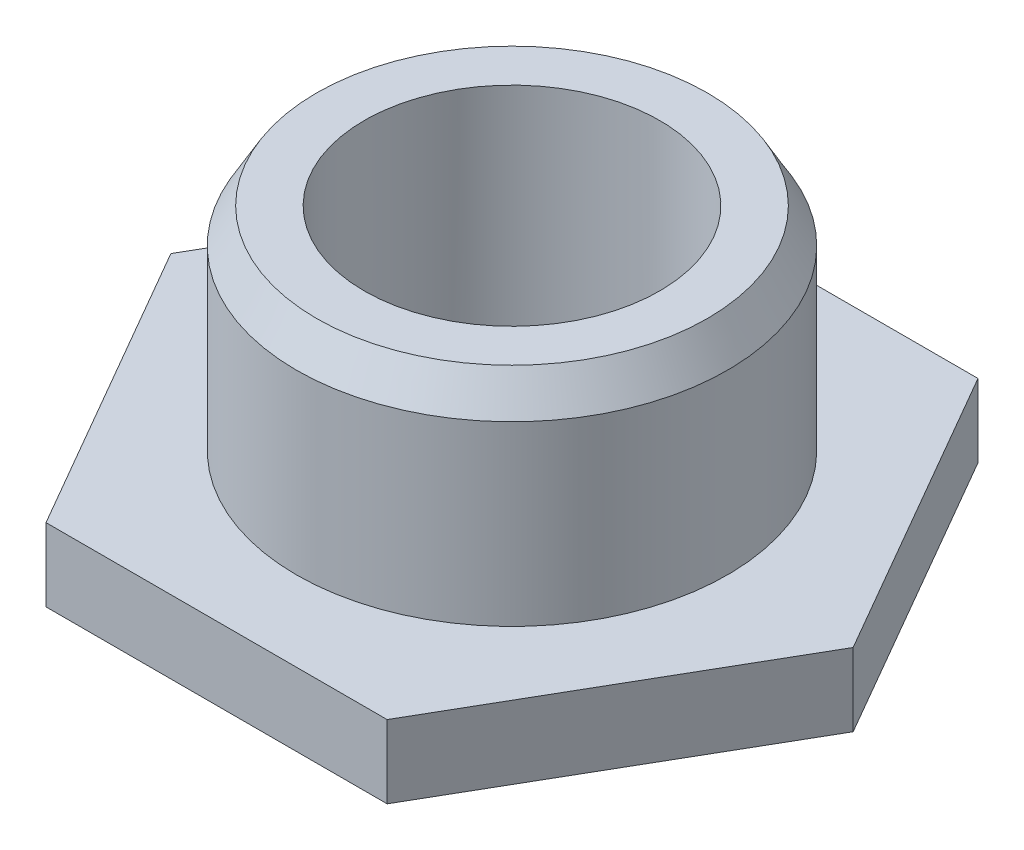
SolidWorks part; units mm, degrees
ref_plane "Front" through (0, 0, 0) normal (0, 0, 1) x (1, 0, 0)
ref_plane "Top" through (0, 0, 0) normal (0, 1, 0) x (1, 0, 0)
ref_plane "Right" through (0, 0, 0) normal (1, 0, 0) x (0, 0, -1)
sketch "Sketch1" plane through (0, 0, 0) normal (0, 1, 0) x (1, 0, 0)
  line L1 (9.815, 0) -> (4.9075, 8.5)
  line L2 (4.9075, 8.5) -> (-4.9075, 8.5)
  line L3 (-4.9075, 8.5) -> (-9.815, 0)
  line L4 (-9.815, 0) -> (-4.9075, -8.5)
  line L5 (-4.9075, -8.5) -> (4.9075, -8.5)
  line L6 (4.9075, -8.5) -> (9.815, 0)
  circle A0 centre (0, 0) radius 8.5 construction
  dimension "D1" = 17
extrude "Boss-Extrude1" add sketch "Sketch1" along normal blind 2.1
sketch "Sketch2" plane through (0, 2.1, 0) normal (0, 1, 0) x (1, 0, 0)
  circle A0 centre (0, 0) radius 6.2
  dimension "D1" = 12.4
extrude "Boss-Extrude2" add sketch "Sketch2" along normal blind 6.1
sketch "Sketch3" plane through (0, 0, 0) normal (1, 0, 0) x (0, 0, -1)
  line L0 (0, 3) -> (7.7, 0)
  line L1 (0, 0) -> (8.5, 0) construction
  line L2 (7.7, 0) -> (0, 0)
  line L3 (0, 0) -> (0, 3)
  line L4 (8.5, 2.1) -> (8.5, 0) construction
  dimension "D1" = 3
  dimension "D2" = 0.8
revolve "Cut-Revolve1" cut sketch "Sketch3" angle 360 about L3
sketch "Sketch4" plane through (0, 8.2, 0) normal (0, 1, 0) x (1, 0, 0)
  circle A0 centre (0, 0) radius 4.25
  dimension "D1" = 8.5
extrude "Cut-Extrude1" cut sketch "Sketch4" against normal through all
chamfer "Chamfer1" distance 1 angle 30 1 edges at (0, 8.2, 6.2)
hole_wizard "M8 Tapped Hole1" positions "Sketch5" profile "Sketch6" tap size "M8" standard "DIN"
sketch "Sketch5" plane through (0, 8.2, 0) normal (0, 1, 0) x (1, 0, 0)
  point P0 (0, 0)
sketch "Sketch6" plane through (0, 8.2, 0) normal (1, 0, 0) x (0, 0, 1)
  line L0 (0, 0) -> (0, 8.2)
  line L1 (0, 8.2) -> (4.5, 8.2)
  line L2 (3.4, 7.1) -> (3.4, 2.1)
  line L3 (3.4, 2.1) -> (5.5, 0)
  line L5 (5.5, 0) -> (0, 0)
  line L6 (-3.4, 2.1) -> (-5.5, 0) construction
  line L7 (4.5, 8.2) -> (3.4, 7.1)
  line L8 (-4.5, 8.2) -> (-3.4, 7.1) construction
  line L11 (0, -6.35) -> (0, 107.95) construction
  dimension "Thru Tap Drill Dia." = 6.8
  dimension "Thru Tap Drill Depth" = 8.2
  dimension "Near C'Sink Dia." = 11
  dimension "Near C'Sink Angle" = 90
  dimension "Far C'Sink Dia." = 9
  dimension "Far C'Sink Angle" = 90
